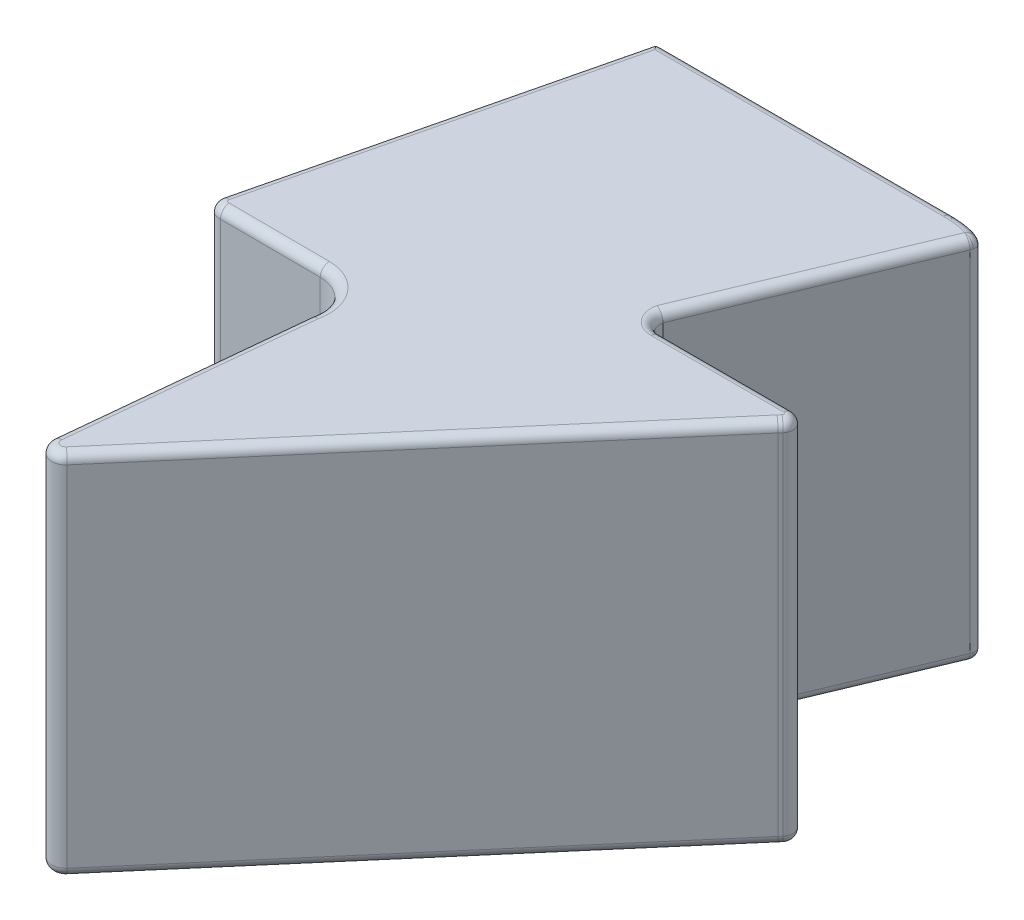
SolidWorks part; units mm, degrees
ref_plane "Front Plane" through (0, 0, 0) normal (0, 0, 1) x (1, 0, 0)
ref_plane "Top Plane" through (0, 0, 0) normal (0, 1, 0) x (1, 0, 0)
ref_plane "Right Plane" through (0, 0, 0) normal (1, 0, 0) x (0, 0, -1)
body saved out of another part "Stock-Wooden Clock Video-1"
fillet "Fillet1" radius 0.5 27 edges at (38.4866, 4, -80.8257) (41.7502, 4, -80.6045) (46.0081, 4, -79.8424) (45.7347, 4, -71.8112) (45.5524, 4, -64.6734) (55.344, 4, -75.2929) (64.323, 4, -85.7864) (64.4745, 4, -86.5023) (60.3186, 4, -86.8504) (56.1083, 4, -87.1309) (56.1083, 24, -87.1309) (60.3186, 24, -86.8504) (64.4745, 24, -86.5023) (64.323, 24, -85.7864) (55.344, 24, -75.2929) (45.7347, 24, -71.8112) (46.0081, 24, -79.8424) (41.7502, 24, -80.6045) (38.4866, 24, -80.8257)
